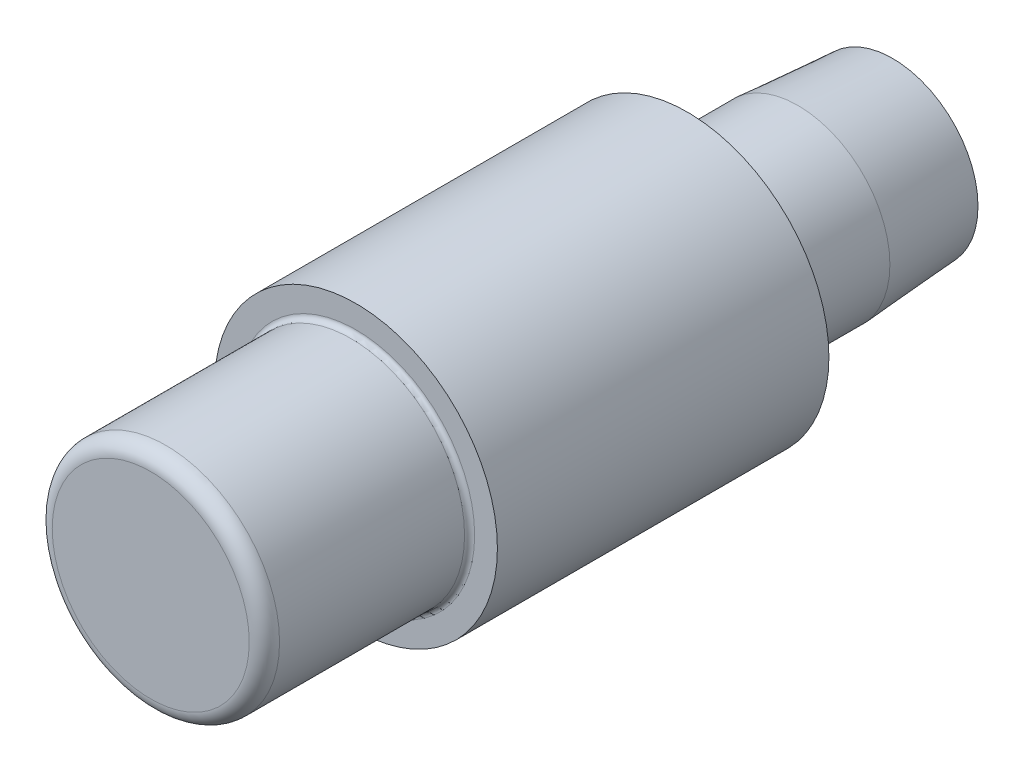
SolidWorks part; units mm, degrees
ref_plane "Front Plane" through (0, 0, 0) normal (0, 0, 1) x (1, 0, 0)
ref_plane "Top Plane" through (0, 0, 0) normal (0, 1, 0) x (1, 0, 0)
ref_plane "Right Plane" through (0, 0, 0) normal (1, 0, 0) x (0, 0, -1)
sketch "Sketch1" plane through (0, 0, 0) normal (0, 0, 1) x (1, 0, 0)
  circle A0 centre (0, 0) radius 2.3114
  dimension "D1" = 4.6228
extrude "Extrude1" add sketch "Sketch1" along normal blind 5.1594
sketch "Sketch2" plane through (0, 0, 5.1594) normal (0, 0, 1) x (1, 0, 0)
  circle A0 centre (0, 0) radius 3.556
  dimension "D1" = 7.112
extrude "Extrude2" add sketch "Sketch2" along normal blind 8.3344
sketch "Sketch3" plane through (0, 0, 13.4937) normal (0, 0, 1) x (1, 0, 0)
  circle A0 centre (0, 0) radius 2.8575
  circle A1 centre (0, 0) radius 3.556 construction
  circle A2 centre (0, 0) radius 3.556 construction
  dimension "D1" = 0.6985
extrude "Extrude4" add sketch "Sketch3" along normal blind 5.1594
fillet "Fillet3" radius 0.381 1 edges at (2.8575, 0, 18.6531)
chamfer "Chamfer2" distance 2.3812 angle 4 1 edges at (2.3114, 0, 0)
fillet "Fillet4" radius 0.381 1 edges at (2.3114, 0, 5.1594)
hole_wizard "3/32 (0.09375) Diameter Hole1" positions "3DSketch1" profile "Sketch9" hole size "3/32" standard "Ansi Inch"
sketch3d "3DSketch1"
  point P0 (0, 0, 0)
  point P2 (0, 0, 0)
sketch "Sketch9" plane through (0, 0, 0) normal (1, 0, 0) x (0, 1, 0)
  line L0 (0, 0) -> (0, 8.6529)
  line L1 (0, 8.6529) -> (1.1906, 7.9375)
  line L2 (1.1906, 7.9375) -> (1.1906, 0)
  line L5 (1.1906, 0) -> (0, 0)
  line L10 (0, 8.6529) -> (-1.1906, 7.9375) construction
  line L11 (0, -6.35) -> (0, 107.95) construction
  dimension "Hole Dia." = 2.3812
  dimension "Hole Depth" = 7.9375
  dimension "Drill Angle" = 118
chamfer "Chamfer3" distance 0.254 angle 45 1 edges at (-1.1906, 0, 0)
fillet "Fillet5" radius 0.127 1 edges at (2.8575, 0, 13.4937)
